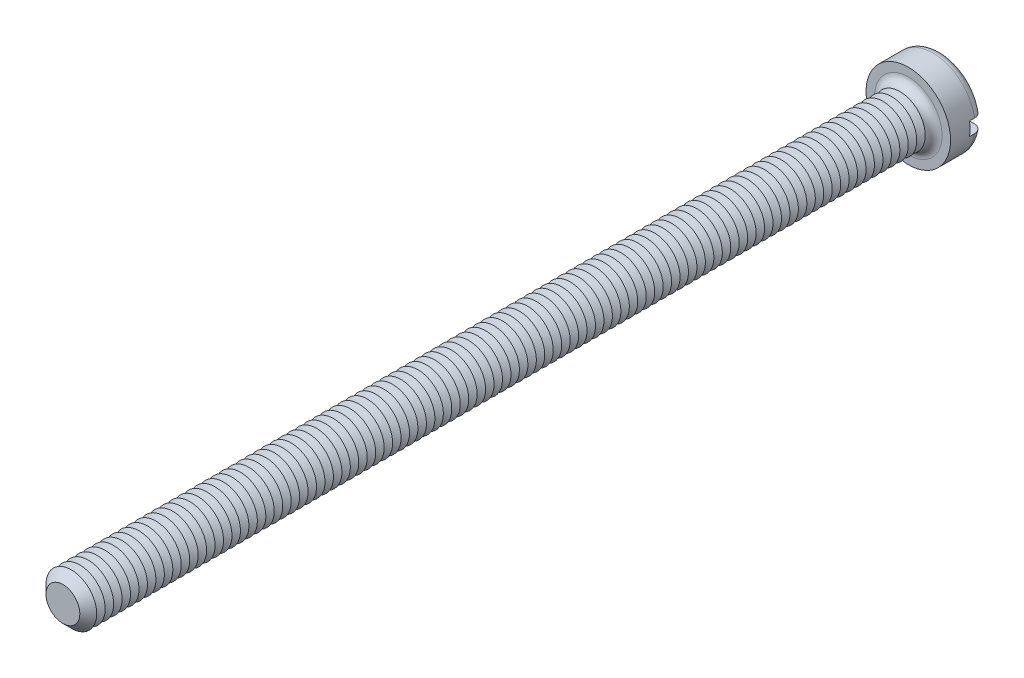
SolidWorks part; units mm, degrees
ref_plane "Front Plane" through (0, 0, 0) normal (0, 0, 1) x (1, 0, 0)
ref_plane "Top Plane" through (0, 0, 0) normal (0, 1, 0) x (1, 0, 0)
ref_plane "Right Plane" through (0, 0, 0) normal (1, 0, 0) x (0, 0, -1)
sketch "Sketch3" plane through (0, 0, 0) normal (0, 0, 1) x (1, 0, 0)
  circle A0 centre (0, 0) radius 5
  dimension "D1" = 10
extrude "Boss-Extrude2" add sketch "Sketch3" against normal blind 3.9
sketch "Sketch4" plane through (0, 0, 0) normal (0, 0, 1) x (1, 0, 0)
  circle A0 centre (0, 0) radius 3
  dimension "D1" = 6
extrude "Boss-Extrude3" add sketch "Sketch4" along normal blind 100
fillet "Fillet1" radius 1 2 edges at (5, 0, -3.9) (3, 0, 0)
chamfer "Chamfer1" distance 1 angle 45 1 edges at (3, 0, 100)
sketch "Sketch5" plane through (0, 0, 0) normal (1, 0, 0) x (0, 0, -1)
  line L0 (1.6944, 0) -> (-7.6738, 0) construction
sketch "Sketch6" plane through (0, 0, 0) normal (1, 0, 0) x (0, 0, -1)
  line L0 (-1, 3) -> (-1.5, 2.134)
  line L1 (-1.5, 2.134) -> (-2, 3)
  line L2 (-1, 3) -> (-99, 3) construction
  line L3 (-2, 3) -> (-1, 3)
  dimension "D1" = 1
revolve "Cut-Revolve1" cut sketch "Sketch6" angle 360 about L0
pattern_linear "LPattern1" count 98 spacing 1 along (0, 0, 1) of "Cut-Revolve1"
sketch "Sketch8" plane through (0, 0, -3.9) normal (0, 0, -1) x (-1, 0, 0)
  line L1 (5, -0.8) -> (-5, -0.8)
  line L2 (5, -0.8) -> (5, 0.8)
  line L3 (5, 0.8) -> (-5, 0.8)
  line L4 (-5, -0.8) -> (-5, 0.8)
  line L5 (5, -0.8) -> (-5, 0.8) construction
  line L6 (5, 0.8) -> (-5, -0.8) construction
  point P0 (0, 0)
  dimension "D1" = 10
  dimension "D2" = 1.6
extrude "Cut-Extrude1" cut sketch "Sketch8" against normal blind 1.6
